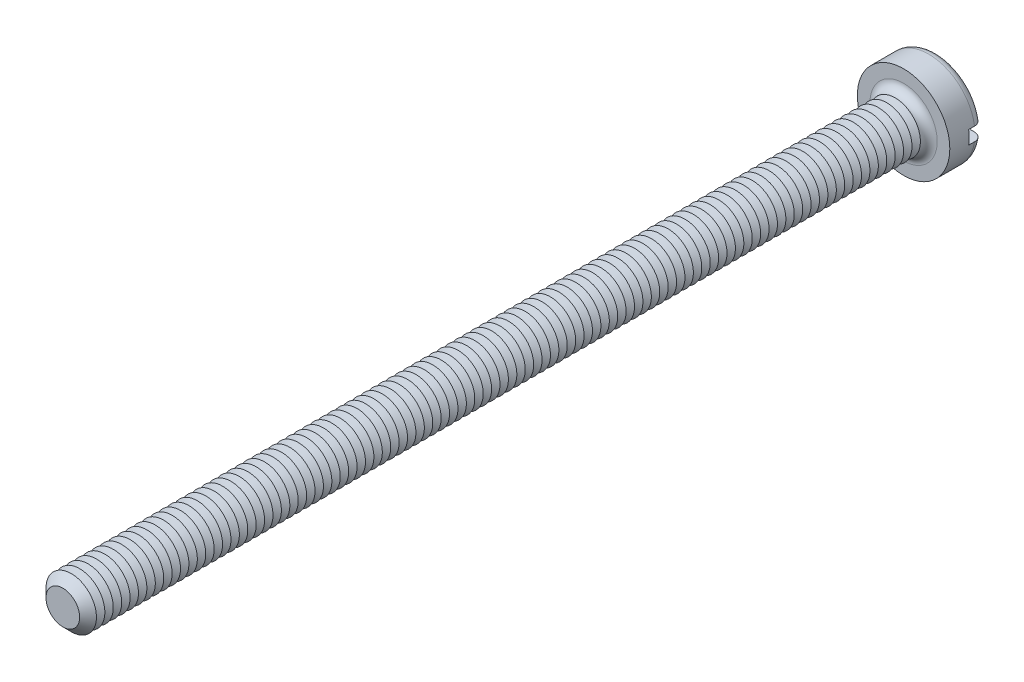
SolidWorks part; units mm, degrees
ref_plane "Front Plane" through (0, 0, 0) normal (0, 0, 1) x (1, 0, 0)
ref_plane "Top Plane" through (0, 0, 0) normal (0, 1, 0) x (1, 0, 0)
ref_plane "Right Plane" through (0, 0, 0) normal (1, 0, 0) x (0, 0, -1)
sketch "Sketch3" plane through (0, 0, 0) normal (0, 0, 1) x (1, 0, 0)
  circle A0 centre (0, 0) radius 2.75
  dimension "D1" = 5.5
extrude "Boss-Extrude2" add sketch "Sketch3" against normal blind 2
sketch "Sketch4" plane through (0, 0, 0) normal (0, 0, 1) x (1, 0, 0)
  circle A0 centre (0, 0) radius 1.5
  dimension "D1" = 3
extrude "Boss-Extrude3" add sketch "Sketch4" along normal blind 50
fillet "Fillet1" radius 0.5 2 edges at (2.75, 0, -2) (1.5, 0, 0)
chamfer "Chamfer1" distance 0.5 angle 45 1 edges at (1.5, 0, 50)
sketch "Sketch5" plane through (0, 0, 0) normal (1, 0, 0) x (0, 0, -1)
  line L0 (1.6944, 0) -> (-7.6738, 0) construction
sketch "Sketch6" plane through (0, 0, 0) normal (1, 0, 0) x (0, 0, -1)
  line L0 (-0.5, 1.5) -> (-0.75, 1.067)
  line L1 (-0.75, 1.067) -> (-1, 1.5)
  line L2 (-0.5, 1.5) -> (-49.5, 1.5) construction
  line L3 (-1, 1.5) -> (-0.5, 1.5)
  dimension "D1" = 0.5
revolve "Cut-Revolve1" cut sketch "Sketch6" angle 360 about L0
pattern_linear "LPattern1" count 98 spacing 0.5 along (0, 0, 1) of "Cut-Revolve1"
sketch "Sketch8" plane through (0, 0, -2) normal (0, 0, -1) x (-1, 0, 0)
  line L1 (2.75, -0.4) -> (-2.75, -0.4)
  line L2 (2.75, -0.4) -> (2.75, 0.4)
  line L3 (2.75, 0.4) -> (-2.75, 0.4)
  line L4 (-2.75, -0.4) -> (-2.75, 0.4)
  line L5 (2.75, -0.4) -> (-2.75, 0.4) construction
  line L6 (2.75, 0.4) -> (-2.75, -0.4) construction
  point P0 (0, 0)
  dimension "D1" = 5.5
  dimension "D2" = 0.8
extrude "Cut-Extrude1" cut sketch "Sketch8" against normal blind 0.85
